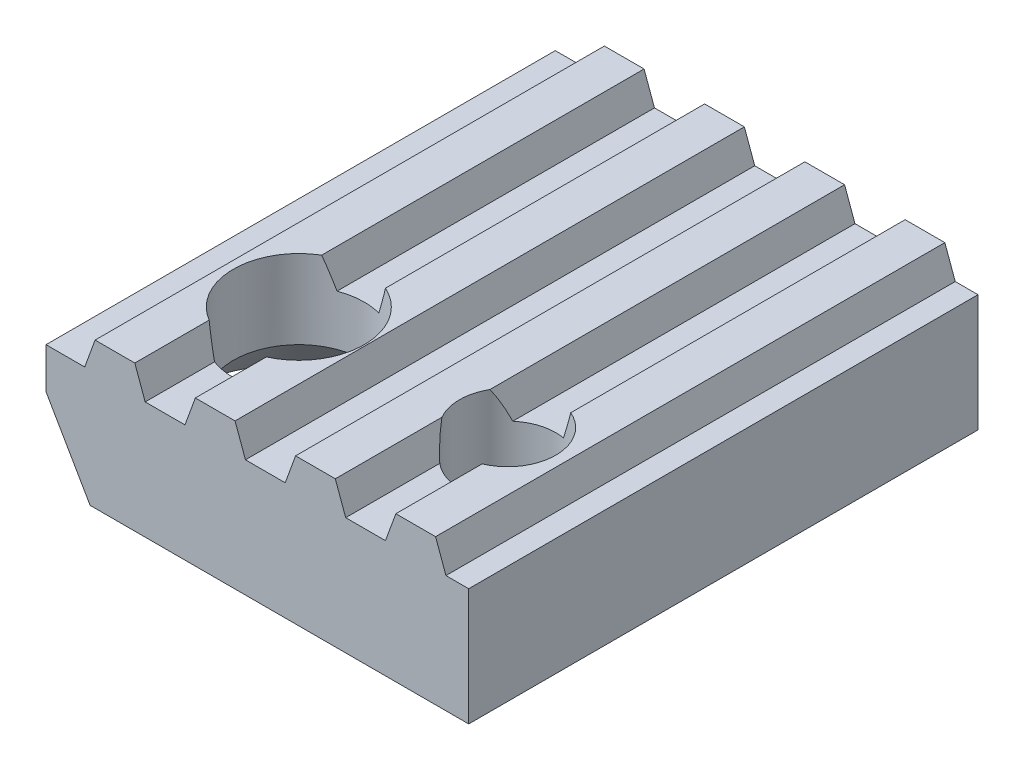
SolidWorks part; units mm, degrees
ref_plane "Front" through (0, 0, 0) normal (0, 0, 1) x (1, 0, 0)
ref_plane "Top" through (0, 0, 0) normal (0, 1, 0) x (1, 0, 0)
ref_plane "Right" through (0, 0, 0) normal (1, 0, 0) x (0, 0, -1)
sketch "Sketch1" plane through (0, 0, 0) normal (0, 0, 1) x (1, 0, 0)
  line L0 (0.9652, 0) -> (1.2241, 0.7112)
  line L1 (1.2241, 0.7112) -> (2.2147, 0.7112)
  line L2 (2.2147, 0.7112) -> (2.4735, 0)
  line L3 (0.9652, 0) -> (2.4735, 0)
  dimension "D1" = 110
  dimension "D2" = 110
  dimension "D3" = 0.9906
  dimension "D4" = 0.7112
  dimension "D5" = 0.9652
extrude "Extrude1" add sketch "Sketch1" along normal blind 12.7
sketch "Sketch2" plane through (0, 0, 0) normal (0, 1, 0) x (1, 0, 0)
  line L0 (2.2147, -12.7) -> (1.2241, -12.7) construction
  line L1 (0, 0) -> (10.541, 0)
  line L2 (0, 0) -> (0, -12.7)
  line L3 (0, -12.7) -> (10.541, -12.7)
  line L4 (10.541, 0) -> (10.541, -12.7)
  dimension "D1" = 10.541
extrude "Extrude2" add sketch "Sketch2" against normal blind 2.921
pattern_linear "LPattern1" count 4 spacing 2.5 along (1, 0, 0) of "Extrude1"
hole_wizard "3/32 (0.09375) Diameter Hole1" positions "Sketch4" profile "Sketch3" hole size "3/32" standard "Ansi Inch"
sketch "Sketch4" plane through (0, -2.921, 0) normal (0, -1, 0) x (1, 0, 0)
  line L1 (8.255, 12.392) -> (8.255, 6.4952) construction
  line L2 (10.541, 12.392) -> (0, 12.392) construction
  line L3 (6.6817, 6.4952) -> (8.0324, 6.4952) construction
  line L4 (10.541, 12.7) -> (10.541, 0) construction
  point P0 (8.255, 9.4436)
  dimension "D1" = 2.286
sketch "Sketch3" plane through (8.255, -2.921, 9.4436) normal (1, 0, 0) x (0, 0, -1)
  line L0 (0, 0) -> (0, 3.6322)
  line L1 (0, 3.6322) -> (1.2001, 3.6322)
  line L2 (1.2001, 3.6322) -> (1.2001, 0)
  line L5 (1.2001, 0) -> (0, 0)
  line L11 (0, -6.35) -> (0, 107.95) construction
  dimension "Thru Hole Dia." = 2.4003
  dimension "Thru Hole Depth" = 3.6322
hole_wizard "CSK for #4 Flat Head Machine Screw1" positions "Sketch6" profile "Sketch5" countersink size "#4" standard "Ansi Inch"
sketch "Sketch6" plane through (0, -2.921, 0) normal (0, -1, 0) x (1, 0, 0)
  line L0 (3.048, 9.4436) -> (8.255, 9.4436) construction
  line L1 (0, 0) -> (0, 12.7) construction
  circle A0 centre (8.255, 9.4436) radius 1.2001 construction
  point P0 (3.048, 9.4436)
  dimension "D1" = 3.048
sketch "Sketch5" plane through (3.048, -2.921, 9.4436) normal (1, 0, 0) x (0, 0, -1)
  line L0 (0, 0) -> (0, 3.6322)
  line L1 (0, 3.6322) -> (1.6319, 3.6322)
  line L2 (1.6319, 3.6322) -> (1.6319, 1.6638)
  line L3 (1.6319, 1.6638) -> (3.0783, 0)
  line L5 (3.0783, 0) -> (0, 0)
  line L6 (-1.632, 1.6638) -> (-3.0783, 0) construction
  line L11 (0, -6.35) -> (0, 107.95) construction
  dimension "Thru Hole Dia." = 3.2639
  dimension "Thru Hole Depth" = 3.6322
  dimension "Near C'Sink Dia." = 6.1566
  dimension "Near C'Sink Angle" = 82
chamfer "Chamfer1" distance 1.905 angle 30 1 edges at (0, -2.921, 4.5064)
